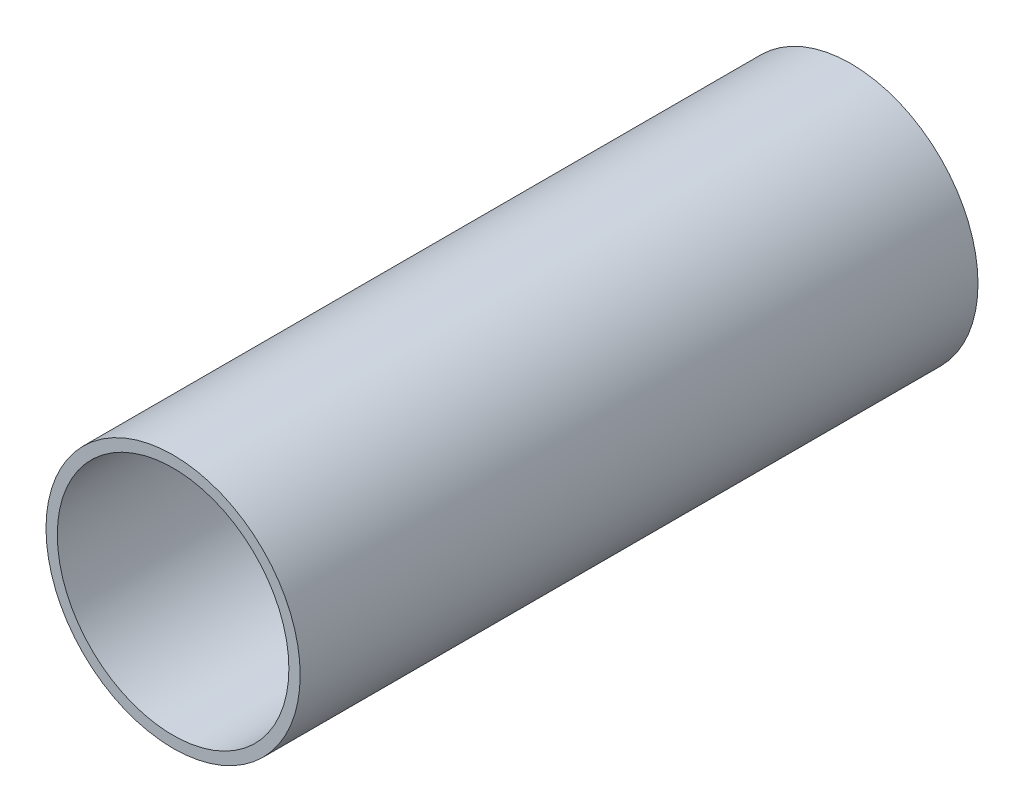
SolidWorks part; units mm, degrees
ref_plane "Plan de face" through (0, 0, 0) normal (0, 0, 1) x (1, 0, 0)
ref_plane "Plan de dessus" through (0, 0, 0) normal (0, 1, 0) x (1, 0, 0)
ref_plane "Plan de droite" through (0, 0, 0) normal (1, 0, 0) x (0, 0, -1)
sketch "Esquisse1" plane through (0, 0, 0) normal (0, 0, 1) x (1, 0, 0)
  circle A0 centre (0, 0) radius 22.5
  circle A1 centre (0, 0) radius 20.5
  dimension "D1" = 45
  dimension "D2" = 2
extrude "Boss.-Extru.1" add sketch "Esquisse1" along normal blind 120
